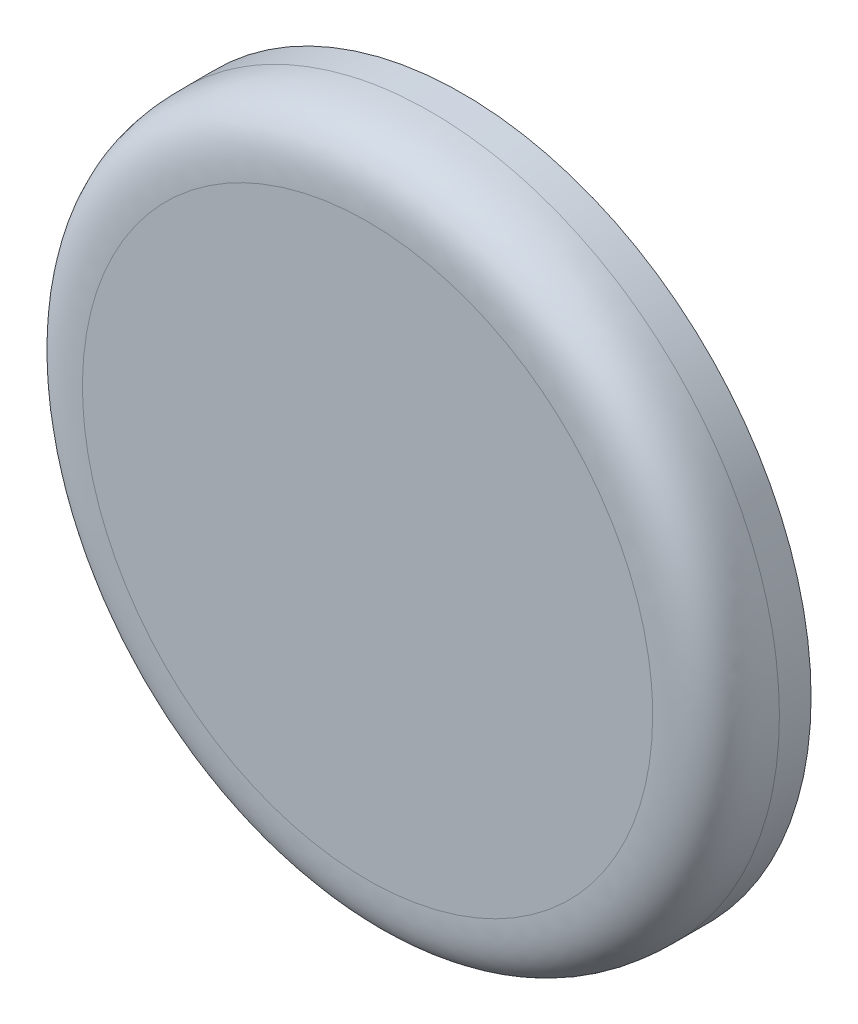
SolidWorks part; units mm, degrees
ref_plane "Plan de face" through (0, 0, 0) normal (0, 0, 1) x (1, 0, 0)
ref_plane "Plan de dessus" through (0, 0, 0) normal (0, 1, 0) x (1, 0, 0)
ref_plane "Plan de droite" through (0, 0, 0) normal (1, 0, 0) x (0, 0, -1)
sketch "Esquisse1" plane through (0, 0, 0) normal (0, 0, 1) x (1, 0, 0)
  circle A0 centre (0, 0) radius 55
  dimension "D1" = 110
extrude "Boss.-Extru.1" add sketch "Esquisse1" along normal blind 15
fillet "Congé1" radius 10 1 edges at (55, 0, 15)
sketch "Esquisse2" plane through (0, 0, 0) normal (0, 0, -1) x (-1, 0, 0)
  circle A0 centre (0, 0) radius 50
  dimension "D1" = 100
extrude "Enlèv. mat.-Extru.1" cut sketch "Esquisse2" against normal blind 3 contours A0
fillet "Congé2" radius 10 1 edges at (-50, 0, 3)
shell "Coque1" thickness 3
sketch "Esquisse3" plane through (0, 0, 0) normal (0, 0, -1) x (-1, 0, 0)
  line L0 (0, 0) -> (-53.5, 0) construction
  arc A4 (-53.4158, -3) -> (-53.4158, 3) centre (0, 0) cw construction
  arc A5 (-53.915, 3.028) -> (-53.915, -3.028) centre (0, 0) ccw
  arc A6 (-52.9166, 2.972) -> (-52.9166, -2.972) centre (0, 0) ccw
  arc A7 (-52.9166, 2.972) -> (-53.915, 3.028) centre (-53.4158, 3) ccw
  arc A8 (-53.915, -3.028) -> (-52.9166, -2.972) centre (-53.4158, -3) ccw
  arc A9 (-3, 53.4158) -> (3, 53.4158) centre (0, 0) cw construction
  arc A10 (3.028, 53.915) -> (-3.028, 53.915) centre (0, 0) ccw
  arc A11 (2.972, 52.9166) -> (-2.972, 52.9166) centre (0, 0) ccw
  arc A12 (2.972, 52.9166) -> (3.028, 53.915) centre (3, 53.4158) ccw
  arc A13 (-3.028, 53.915) -> (-2.972, 52.9166) centre (-3, 53.4158) ccw
  arc A14 (53.4158, 3) -> (53.4158, -3) centre (0, 0) cw construction
  arc A15 (53.915, -3.028) -> (53.915, 3.028) centre (0, 0) ccw
  arc A16 (52.9166, -2.972) -> (52.9166, 2.972) centre (0, 0) ccw
  arc A17 (52.9166, -2.972) -> (53.915, -3.028) centre (53.4158, -3) ccw
  arc A18 (53.915, 3.028) -> (52.9166, 2.972) centre (53.4158, 3) ccw
  arc A19 (3, -53.4158) -> (-3, -53.4158) centre (0, 0) cw construction
  arc A20 (-3.028, -53.915) -> (3.028, -53.915) centre (0, 0) ccw
  arc A21 (-2.972, -52.9166) -> (2.972, -52.9166) centre (0, 0) ccw
  arc A22 (-2.972, -52.9166) -> (-3.028, -53.915) centre (-3, -53.4158) ccw
  arc A23 (3.028, -53.915) -> (2.972, -52.9166) centre (3, -53.4158) ccw
  point P5 (-53.5, 0)
  point P15 (0, 53.5)
  point P22 (53.5, 0)
  point P29 (0, -53.5)
  point P34 (0, 0)
  dimension "D2" = 1
  dimension "D3" = 0
  dimension "D5" = 6
  dimension "D1" = 53.5
  dimension "D4" = 0
  dimension "D6" = 4
extrude "Enlèv. mat.-Extru.3" cut sketch "Esquisse3" against normal blind 3 contours A6 A8 A5 A7 | A11 A13 A10 A12 | A16 A18 A15 A17 | A21 A23 A20 A22
ref_plane "Plan1" through (0, 0, 0) normal (-0.0561, 0.9984, 0) x (0.9984, 0.0561, 0)
sketch "Esquisse4" plane through (0, 0, 0) normal (-0.0561, 0.9984, 0) x (0.9984, 0.0561, 0)
  line L0 (53, -3) -> (54, -3)
  line L1 (53, -3) -> (53, -2)
  line L2 (54, -3) -> (54, -2)
  line L3 (53, -2) -> (54, -2)
  dimension "D1" = 1
revolve "Enlèvement de matière-Révolution1" cut sketch "Esquisse4" angle 5 about axis through (0, 0, 15) along (0, 0, -1)
pattern_circular "Répétition circulaire1" count 4 every 90 about axis through (0, 0, 15) along (0, 0, -1) of "Enlèvement de matière-Révolution1"
